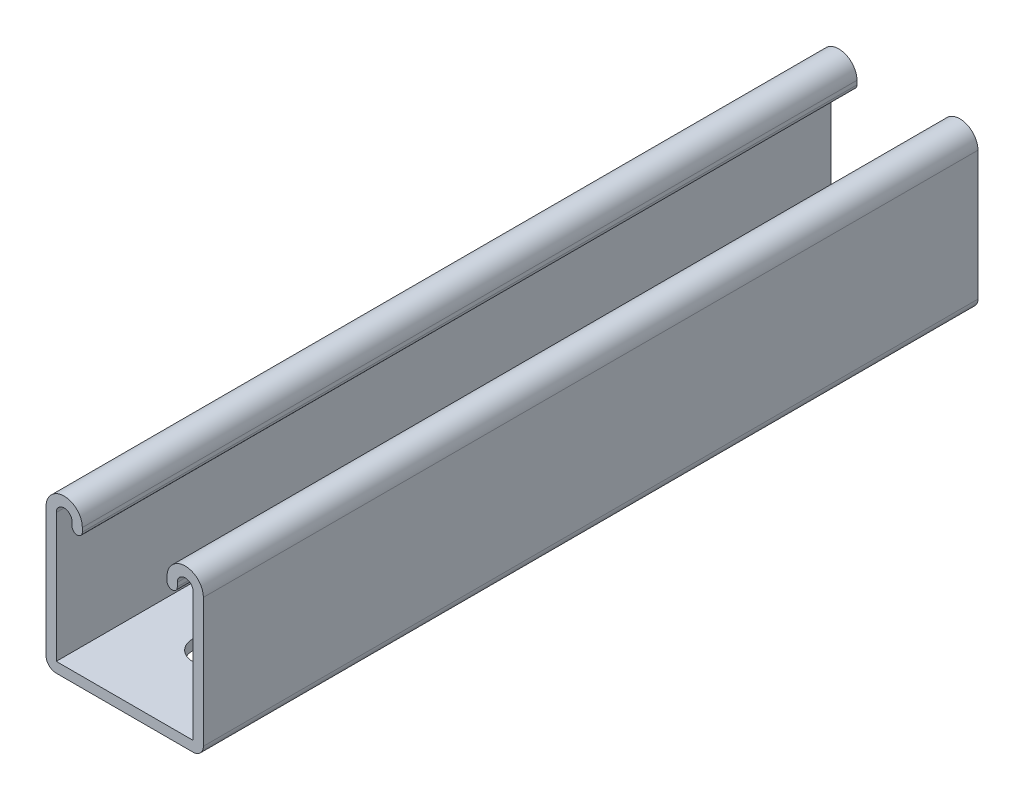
SolidWorks part; units mm, degrees
ref_plane "Plane1" through (0, 0, 0) normal (0, 0, 1) x (1, 0, 0)
ref_plane "Plane2" through (0, 0, 0) normal (0, 1, 0) x (1, 0, 0)
ref_plane "Plane3" through (0, 0, 0) normal (1, 0, 0) x (0, 0, -1)
sketch "Sketch1" plane through (0, 0, 0) normal (0, 0, 1) x (1, 0, 0)
  line L0 (-20.6375, 18.4785) -> (-20.6375, -15.3416)
  line L1 (-17.9451, -18.034) -> (17.9451, -18.034)
  line L2 (20.6375, -15.3416) -> (20.6375, 18.4785)
  line L3 (11.1125, 18.4785) -> (11.1125, 17.4434)
  line L4 (-11.1125, 18.4785) -> (-11.1125, 17.4434)
  line L5 (-13.8049, 18.4785) -> (-13.8049, 17.4434)
  line L6 (-17.9451, 18.4785) -> (-17.9451, -15.3416)
  line L7 (-17.9451, -15.3416) -> (17.9451, -15.3416)
  line L8 (17.9451, -15.3416) -> (17.9451, 18.4785)
  line L9 (13.8049, 18.4785) -> (13.8049, 17.4434)
  line L10 (-25.4, 23.241) -> (25.4, 23.241) construction
  line L11 (-12.8524, 16.0972) -> (12.8524, 16.0972) construction
  arc A0 (20.6375, 18.4785) -> (11.1125, 18.4785) centre (15.875, 18.4785) ccw
  arc A1 (-20.6375, 18.4785) -> (-11.1125, 18.4785) centre (-15.875, 18.4785) cw
  arc A2 (-17.9451, -18.034) -> (-20.6375, -15.3416) centre (-17.9451, -15.3416) cw
  arc A3 (17.9451, -18.034) -> (20.6375, -15.3416) centre (17.9451, -15.3416) ccw
  arc A4 (-17.9451, 18.4785) -> (-13.8049, 18.4785) centre (-15.875, 18.4785) cw
  arc A5 (17.9451, 18.4785) -> (13.8049, 18.4785) centre (15.875, 18.4785) ccw
  arc A6 (11.1125, 17.4434) -> (13.8049, 17.4434) centre (12.4587, 17.4434) ccw
  arc A7 (-11.1125, 17.4434) -> (-13.8049, 17.4434) centre (-12.4587, 17.4434) cw
  dimension "D1" = 2.6924
  dimension "D3" = 20.6375
  dimension "Width" = 41.275
  dimension "D5" = 18.034
  dimension "D6" = 9.525
  dimension "D7" = 22.225
  dimension "D8" = 23.241
  dimension "D9" = 7.1437
  dimension "gauge" = 2.6924
extrude "Base-Extrude" add sketch "Sketch1" along normal blind 203.2
extrude "LSlot" cut sketch "Sketch2" against normal through all
sketch "Sketch2" plane through (1.3083, -18.034, -10.1488) normal (0, -1, 0) x (1, 0, 0)
  line L0 (3.8511, 88.73) -> (3.8511, 22.8488)
  line L1 (-6.4677, 22.8488) -> (-6.4677, 88.73)
  arc A0 (-6.4677, 22.8488) -> (3.8511, 22.8488) centre (-1.3083, 22.8488) ccw
  arc A1 (3.8511, 88.73) -> (-6.4677, 88.73) centre (-1.3083, 88.73) ccw
  dimension "D3" = 10.3187
  dimension "D1" = 12.7
  dimension "D2" = 65.8813
pattern_linear "LPattern1" count 2 spacing 101.6 along (0, 0, 1) of "LSlot"
equation "\"D3@Sketch1\" = \"Width@Sketch1\" / 2"
equation "\"D7@Sketch1\" = \"Width@Sketch1\" - 2 * \"D6@Sketch1\""
equation "\"D1@Sketch1\" = \"gauge@Sketch1\""
equation "\"D1@LPattern1\" = \"D1@Base-Extrude\" / \"D3@LPattern1\""
